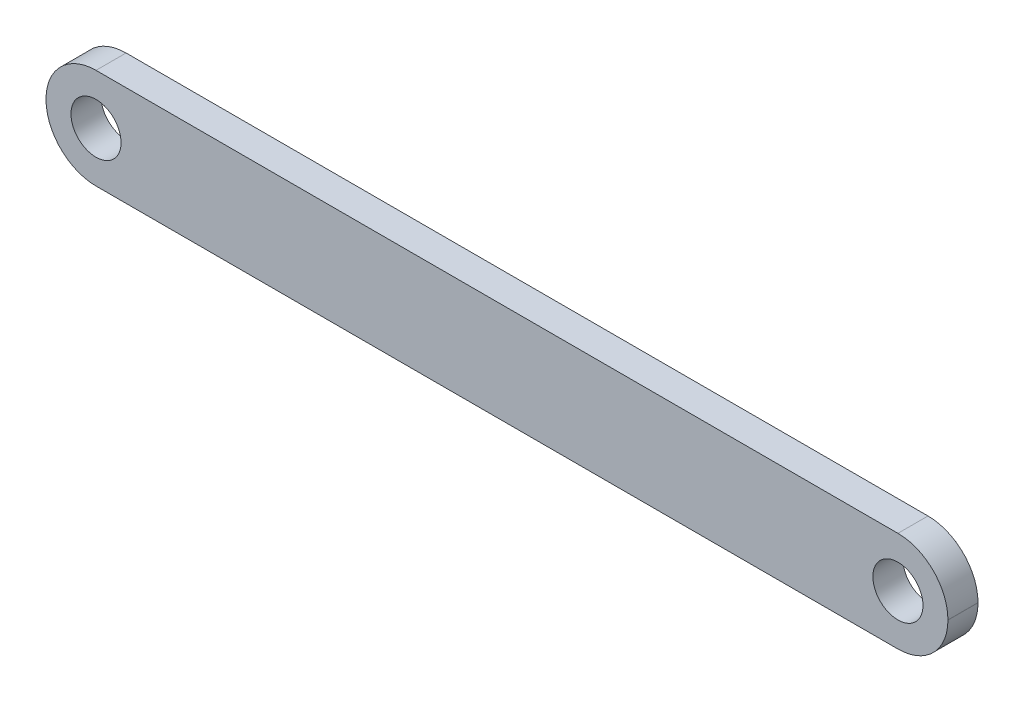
SolidWorks part; units mm, degrees
ref_plane "Plan de face" through (0, 0, 0) normal (0, 0, 1) x (1, 0, 0)
ref_plane "Plan de dessus" through (0, 0, 0) normal (0, 1, 0) x (1, 0, 0)
ref_plane "Plan de droite" through (0, 0, 0) normal (1, 0, 0) x (0, 0, -1)
sketch "Esquisse1" plane through (0, 0, 0) normal (0, 0, 1) x (1, 0, 0)
  line L1 (-34.9638, 13.2473) -> (45.0562, 13.2473)
  line L2 (-39.9538, 8.2573) -> (-39.9538, 8.2373)
  line L3 (-34.9638, 3.2473) -> (45.0562, 3.2473)
  line L4 (50.0462, 8.2573) -> (50.0462, 8.2373)
  arc A0 (-39.9538, 8.2573) -> (-34.9638, 13.2473) centre (-34.9638, 8.2573) cw
  arc A1 (-34.9638, 3.2473) -> (-39.9538, 8.2373) centre (-34.9638, 8.2373) cw
  arc A2 (50.0462, 8.2373) -> (45.0562, 3.2473) centre (45.0562, 8.2373) cw
  arc A3 (45.0562, 13.2473) -> (50.0462, 8.2573) centre (45.0562, 8.2573) cw
  circle A4 centre (-34.9638, 8.2373) radius 2.5
  circle A5 centre (45.0562, 8.2573) radius 2.5
  point P6 (-39.9538, 13.2473)
  point P9 (-39.9538, 3.2473)
  point P14 (50.0462, 13.2473)
  dimension "D3" = 4.99
  dimension "D4" = 5
  dimension "D5" = 5
  dimension "D1" = 90
  dimension "D2" = 10
extrude "Extrusion1" add sketch "Esquisse1" along normal blind 3
